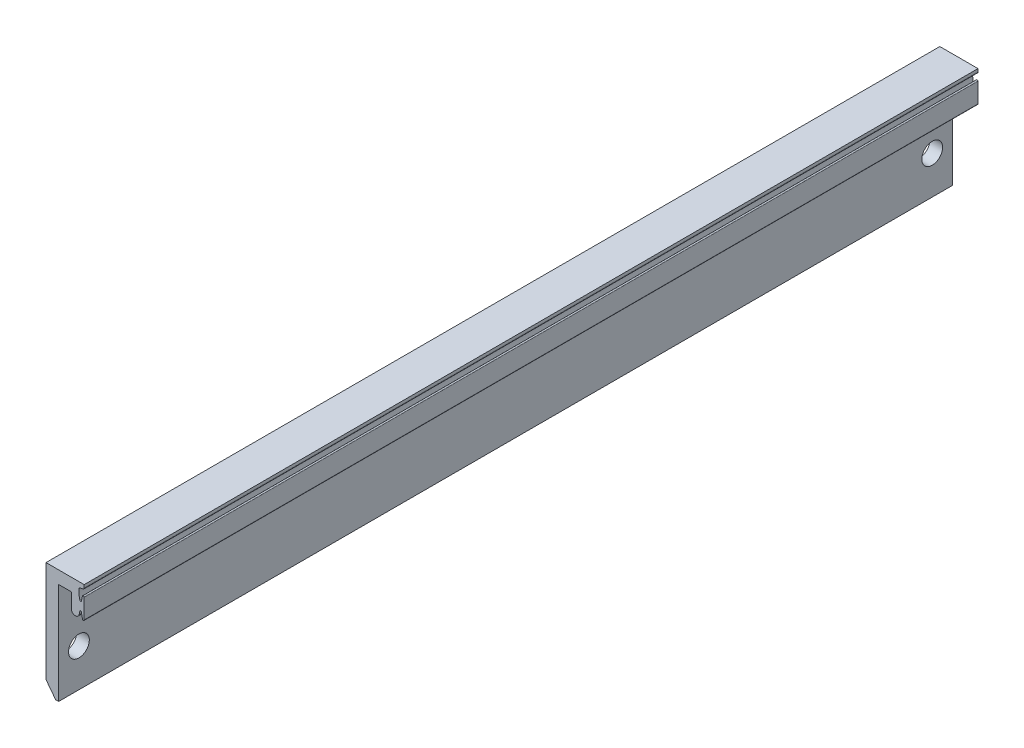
SolidWorks part; units mm, degrees
ref_plane "前视基准面" through (0, 0, 0) normal (0, 0, 1) x (1, 0, 0)
ref_plane "上视基准面" through (0, 0, 0) normal (0, 1, 0) x (1, 0, 0)
ref_plane "右视基准面" through (0, 0, 0) normal (1, 0, 0) x (0, 0, -1)
sketch "草图1" plane through (0, 0, 0) normal (0, 0, 1) x (1, 0, 0)
  line L1704 (2468.3526, -3235.8771) -> (2475.8926, -3235.8771)
  line L1705 (2470.8526, -3238.3771) -> (2473.3526, -3238.3771)
  line L1706 (2468.3526, -3235.8771) -> (2468.3526, -3255.8771)
  line L1707 (2470.8526, -3238.3771) -> (2470.8526, -3258.3771)
  line L1708 (2470.8526, -3258.3771) -> (2470.2526, -3258.3771)
  line L1709 (2468.3526, -3255.8771) -> (2470.2526, -3258.3771)
  line L1710 (2473.3526, -3238.3771) -> (2473.3526, -3241.2434)
  line L1711 (2473.3526, -3238.3771) -> (2473.3526, -3241.2938)
  line L1712 (2475.8926, -3238.0396) -> (2475.8926, -3241.8646)
  line L1713 (2474.9017, -3241.456) -> (2475.0378, -3240.8129)
  line L1714 (2475.8926, -3238.0529) -> (2475.8926, -3241.9013)
  line L1715 (2475.0915, -3236.8368) -> (2475.6405, -3236.7479)
  line L1716 (2475.3296, -3240.8224) -> (2475.5558, -3241.9417)
  line L1717 (2475.5569, -3238.0076) -> (2475.3287, -3238.9862)
  line L1718 (2475.8926, -3235.8771) -> (2475.8926, -3236.4518)
  arc A580 (2474.8396, -3237.1209) -> (2475.0336, -3238.9696) centre (2481.2807, -3237.3796) ccw
  arc A581 (2475.6405, -3236.7479) -> (2475.8926, -3236.4518) centre (2475.5926, -3236.4518) ccw
  arc A582 (2475.0915, -3236.8368) -> (2474.8396, -3237.1209) centre (2475.1394, -3237.133) ccw
  arc A583 (2475.3296, -3240.8224) -> (2475.0343, -3240.8293) centre (2475.1826, -3240.8521) ccw
  arc A584 (2475.5558, -3241.9417) -> (2475.8926, -3241.9013) centre (2475.7226, -3241.908) ccw
  arc A585 (2475.0336, -3238.9696) -> (2475.3287, -3238.9862) centre (2475.1826, -3238.9521) ccw
  arc A586 (2475.8926, -3238.0529) -> (2475.5569, -3238.0076) centre (2475.7226, -3238.0462) ccw
  arc A587 (2473.3526, -3241.2938) -> (2474.9017, -3241.456) centre (2474.1356, -3241.2938) ccw
extrude "凸台-拉伸1" add sketch "草图1" along normal mid plane 176.45 contours L1711 A587 L1713 A583 L1716 A584 L1714 L1712 A586 L1717 A585 A580 A582 L1715 A581 L1718 L1704 L1706 L1709 L1708 L1707 L1705 L1710
sketch "草图2" plane through (2468.3526, 0, 0) normal (-1, 0, 0) x (0, 0, 1)
  line L0 (-88.225, -3235.8771) -> (-88.225, -3255.8771) construction
  line L1 (88.225, -3235.8771) -> (-88.225, -3235.8771) construction
  line L2 (0, -3235.8771) -> (0, -3258.3771) construction
  line L3 (88.225, -3258.3771) -> (-88.225, -3258.3771) construction
  circle A0 centre (-84.225, -3250.8771) radius 2.05
  circle A1 centre (84.225, -3250.8771) radius 2.05
  dimension "D1" = 4.1
  dimension "D2" = 4
  dimension "D3" = 15
extrude "切除-拉伸1" cut sketch "草图2" against normal through all
equation "\"切除-拉伸2\" = if ( \"D1@凸台-拉伸1\" = 265.35 , \"unsuppressed\" , \"suppressed\" )"
